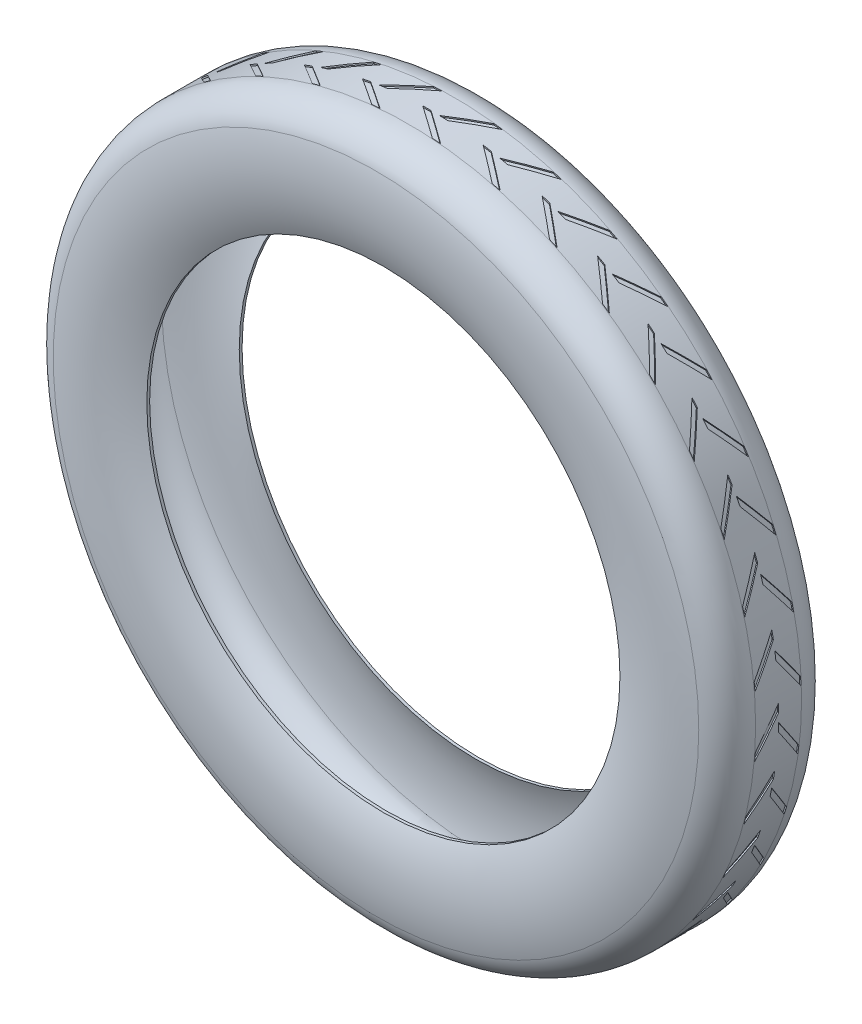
SolidWorks part; units mm, degrees
ref_plane "Front Plane" through (0, 0, 0) normal (0, 0, 1) x (1, 0, 0)
ref_plane "Top Plane" through (0, 0, 0) normal (0, 1, 0) x (1, 0, 0)
ref_plane "Right Plane" through (0, 0, 0) normal (1, 0, 0) x (0, 0, -1)
sketch "Sketch1" plane through (0, 0, 0) normal (1, 0, 0) x (0, 0, -1)
  line L0 (-238.8817, 0) -> (254.3572, 0) construction
  line L1 (0, 366.0243) -> (0, -377.1172) construction
  line L2 (-22.25, 336.5) -> (22.25, 336.5)
  line L5 (-46.1124, 229) -> (46.1124, 229)
  arc A0 (-53.2501, 312.4367) -> (-46.1124, 229) centre (69.7817, 280.938) ccw
  arc A1 (53.2501, 312.4367) -> (46.1124, 229) centre (-69.7817, 280.938) cw
  arc A2 (22.25, 336.5) -> (53.2501, 312.4367) centre (22.25, 304.5) cw
  arc A3 (-22.25, 336.5) -> (-53.2501, 312.4367) centre (-22.25, 304.5) ccw
  dimension "D2" = 44.5
  dimension "D4" = 127
  dimension "D1" = 32
  dimension "D5" = 673
  dimension "D3" = 458
  dimension "D6" = 38.5
revolve "Revolve1" add sketch "Sketch1" angle 360 about L0
shell "Shell1" thickness 2.5
ref_plane "Plane1" through (0, 355.6, 0) normal (0, 1, 0) x (-1, 0, 0)
sketch "Sketch4" plane through (0, 355.6, 0) normal (0, 1, 0) x (-1, 0, 0)
  line L0 (0, 0) -> (146.7568, 0) construction
  line L1 (0, 0) -> (-31.1278, 21.7959)
  line L3 (-31.1278, 21.7959) -> (-23.1278, 21.7959)
  line L4 (-23.1278, 21.7959) -> (8, 0)
  line L5 (8, 0) -> (0, 0)
  line L6 (42.5, 0) -> (11.3722, -21.7959)
  line L8 (11.3722, -21.7959) -> (19.3722, -21.7959)
  line L9 (19.3722, -21.7959) -> (50.5, 0)
  line L10 (50.5, 0) -> (42.5, 0)
  dimension "D1" = 8
  dimension "D2" = 8
  dimension "D3" = 38
  dimension "D4" = 145
  dimension "D5" = 38
  dimension "D6" = 145
  dimension "D7" = 34.5
wrap "Wrap1" sketch "Sketch4" wrap type deboss source sketch "Sketch4" thickness 1.25 parameters "D1"=1.25
pattern_circular "CirPattern1" count 36 over 360 about axis through (0, 0, -46.1124) along (0, 0, 1) of "Wrap1"
